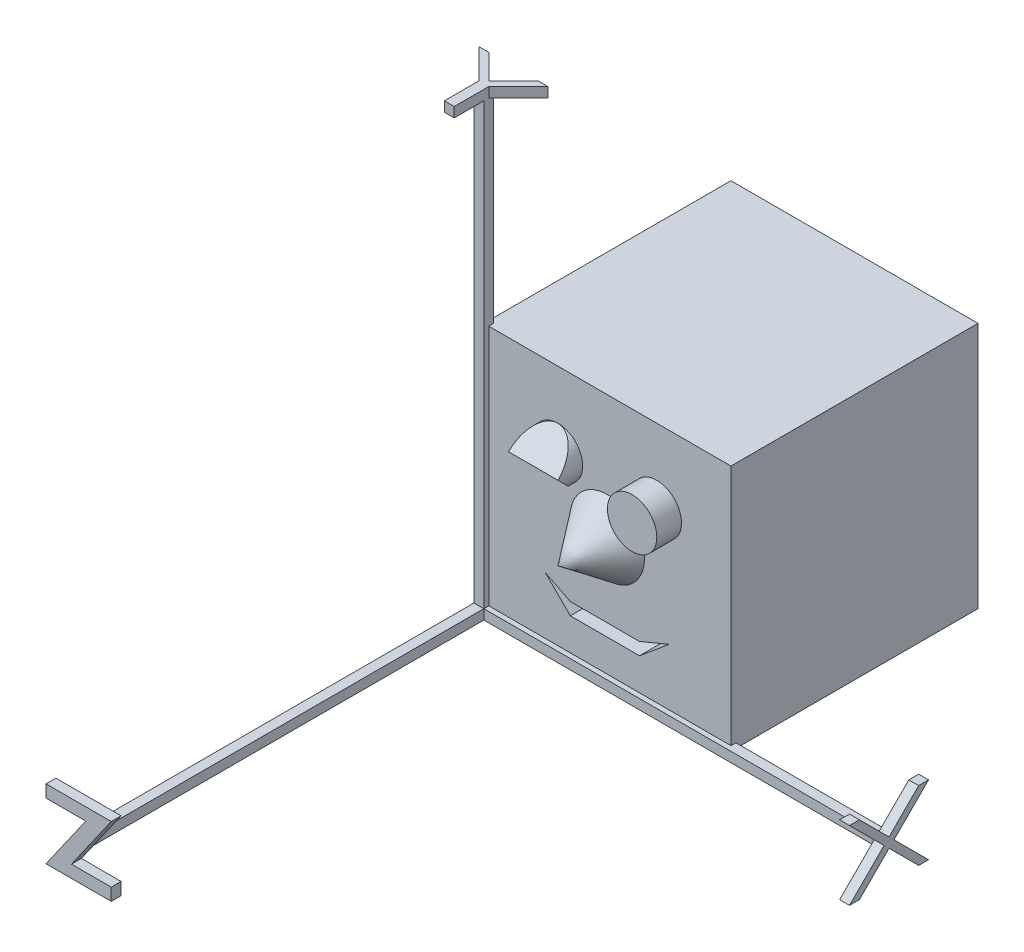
SolidWorks part; units mm, degrees
ref_plane "Front Plane" through (0, 0, 0) normal (0, 0, 1) x (1, 0, 0)
ref_plane "Top Plane" through (0, 0, 0) normal (0, 1, 0) x (1, 0, 0)
ref_plane "Right Plane" through (0, 0, 0) normal (1, 0, 0) x (0, 0, -1)
sketch "Sketch1" plane through (0, 0, 0) normal (0, 0, 1) x (1, 0, 0)
  line L1 (0, 0) -> (25, 0)
  line L2 (0, 0) -> (0, 25)
  line L3 (0, 25) -> (25, 25)
  line L4 (25, 0) -> (25, 25)
  dimension "D1" = 25
  dimension "D2" = 25
extrude "Extrude1" add sketch "Sketch1" against normal blind 25
sketch "Sketch2" plane through (0, 0, 0) normal (0, 0, 1) x (1, 0, 0)
  line L0 (0, 25) -> (0, 0) construction
  line L1 (25, 25) -> (0, 25) construction
  circle A0 centre (7.5, 17.5) radius 2.5
  dimension "D3" = 5
  dimension "D1" = 7.5
  dimension "D2" = 7.5
extrude "Extrude2" add sketch "Sketch2" along normal blind 10
sketch "Sketch3" plane through (0, 0, 0) normal (-1, 0, 0) x (0, 0, 1)
  line L0 (0, 20) -> (12, 20)
  line L1 (12, 20) -> (12, 15)
  line L2 (12, 15) -> (0, 15)
  line L3 (0, 15) -> (2.5, 17.5)
  line L4 (2.5, 17.5) -> (0, 20)
  line L6 (0, 25) -> (0, 0) construction
  line L7 (-25, 25) -> (0, 25) construction
  dimension "D1" = 12
  dimension "D2" = 12
  dimension "D3" = 5
  dimension "D4" = 5
  dimension "D5" = 2.5
  dimension "D6" = 2.5
extrude "Cut-Extrude1" cut sketch "Sketch3" against normal through all
sketch "Sketch4" plane through (0, 0, 0) normal (0, 0, 1) x (1, 0, 0)
  line L0 (0, 25) -> (0, 0) construction
  line L1 (25, 25) -> (0, 25) construction
  circle A0 centre (17.5, 17.5) radius 2.5
  dimension "D3" = 5
  dimension "D1" = 17.5
  dimension "D2" = 7.5
extrude "Extrude3" add sketch "Sketch4" along normal blind 2.5
sketch "Sketch9" plane through (0, 0, 0) normal (0, 0, 1) x (1, 0, 0)
  line L0 (0, 25) -> (0, 0) construction
  line L1 (25, 25) -> (0, 25) construction
  circle A0 centre (12.5, 12.5) radius 3.75
  dimension "D3" = 7.5
  dimension "D1" = 12.5
  dimension "D2" = 12.5
sketch "Sketch10" plane through (0, 0, 0) normal (0, 0, 1) x (1, 0, 0)
  line L0 (6.25, 6.25) -> (8.75, 5)
  line L1 (8.75, 5) -> (15.75, 5)
  line L2 (15.75, 5) -> (18.75, 6.25)
  line L3 (18.75, 6.25) -> (15.75, 3.75)
  line L4 (15.75, 3.75) -> (8.75, 3.75)
  line L5 (8.75, 3.75) -> (6.25, 6.25)
  line L6 (0, 25) -> (0, 0) construction
  line L7 (0, 0) -> (25, 0) construction
  dimension "D1" = 8.75
  dimension "D2" = 6.25
  dimension "D3" = 7
  dimension "D4" = 18.75
  dimension "D5" = 5
  dimension "D6" = 6.25
  dimension "D7" = 3.75
extrude "Cut-Extrude2" cut sketch "Sketch10" against normal blind 2.5
ref_plane "Plane1" through (12.5, 0, 0) normal (1, 0, 0) x (0, 0, -1)
sketch "Sketch13" plane through (12.5, 0, 0) normal (1, 0, 0) x (0, 0, -1)
  line L0 (0, 12.5) -> (-20.0611, 12.5) construction
  line L1 (0, 0) -> (0, 25) construction
  line L3 (0, 12.5) -> (-5, 12.5)
  line L4 (-5, 12.5) -> (0, 16.25)
  line L5 (0, 16.25) -> (0, 12.5)
  dimension "D1" = 5
  dimension "D2" = 3.75
revolve "Revolve1" add sketch "Sketch13" angle 360 about L0
sketch "Sketch14" plane through (0, 0, 0) normal (0, -1, 0) x (1, 0, 0)
  line L0 (0, -25) -> (0, 0) construction
  line L1 (-0.5, -0.5) -> (0.5, -0.5)
  line L2 (-0.5, -0.5) -> (-0.5, 0.5)
  line L3 (-0.5, 0.5) -> (0.5, 0.5)
  line L4 (0.5, -0.5) -> (0.5, 0.5)
  line L5 (0, 0) -> (25, 0) construction
  dimension "D1" = 0.5
  dimension "D2" = 1
  dimension "D3" = 0.5
  dimension "D4" = 1
extrude "Extrude4" add sketch "Sketch14" against normal blind 45
sketch "Sketch16" plane through (0, 45, 0) normal (0, 1, 0) x (-1, 0, 0)
  line L0 (0.5, 3.5) -> (0.5, 0)
  line L1 (0.5, 0.5) -> (0.5, -0.5) construction
  line L2 (0.5, 0) -> (3.5, -3)
  line L3 (3.5, -3) -> (2.5, -3)
  line L4 (2.5, -3) -> (0, -0.5)
  line L5 (0.5, -0.5) -> (-0.5, -0.5) construction
  line L6 (0, -0.5) -> (-2.5, -3)
  line L7 (-2.5, -3) -> (-3.5, -3)
  line L8 (-3.5, -3) -> (-0.5, 0)
  line L9 (-0.5, -0.5) -> (-0.5, 0.5) construction
  line L10 (-0.5, 0) -> (-0.5, 3.5)
  line L11 (-0.5, 3.5) -> (0.5, 3.5)
  line L12 (-0.5, 0.5) -> (0.5, 0.5) construction
  dimension "D1" = 3
  dimension "D2" = 2.5
  dimension "D3" = 135
  dimension "D4" = 90
extrude "Extrude5" add sketch "Sketch16" along normal blind 1
sketch "Sketch17" plane through (0, 0, 0) normal (0, 0, 1) x (1, 0, 0)
  line L0 (0.5, 0) -> (25, 0) construction
  line L1 (-0.5, 0.5) -> (0.5, 0.5)
  line L2 (-0.5, 0.5) -> (-0.5, -0.5)
  line L3 (-0.5, -0.5) -> (0.5, -0.5)
  line L4 (0.5, 0.5) -> (0.5, -0.5)
  line L5 (0, 25) -> (0, 0) construction
  dimension "D1" = 0.5
  dimension "D2" = 1
  dimension "D3" = 0.5
  dimension "D4" = 1
extrude "Extrude6" add sketch "Sketch17" along normal blind 40
sketch "Sketch18" plane through (0, 0, 40) normal (0, 0, 1) x (1, 0, 0)
  line L0 (-0.5, 0.5) -> (0.7254, 2.25)
  line L1 (0.7254, 2.25) -> (-3.3008, 2.25)
  line L2 (-3.3008, 2.25) -> (-3.3008, 3.5)
  line L3 (-3.3008, 3.5) -> (3.3008, 3.5)
  line L4 (3.3008, 3.5) -> (0.5, -0.5)
  line L5 (0.5, -0.5) -> (-0.7254, -2.25)
  line L6 (-0.7254, -2.25) -> (3.3008, -2.25)
  line L7 (3.3008, -2.25) -> (3.3008, -3.5)
  line L8 (3.3008, -3.5) -> (-3.3008, -3.5)
  line L9 (-3.3008, -3.5) -> (-0.5, 0.5)
  line L10 (0.5, 0.5) -> (-0.5, 0.5) construction
  line L11 (-0.5, -0.5) -> (0.5, -0.5) construction
  line L12 (0.5, 0) -> (-0.5, 0) construction
  line L13 (0.5, 0) -> (25, 0) construction
  dimension "D1" = 55
  dimension "D2" = 3.5
  dimension "D3" = 3.5
  dimension "D4" = 1.25
extrude "Extrude7" add sketch "Sketch18" along normal blind 1
sketch "Sketch19" plane through (0, 0, 0) normal (-1, 0, 0) x (0, 0, 1)
  line L1 (-0.5, 0.5) -> (0.5, 0.5)
  line L2 (-0.5, 0.5) -> (-0.5, -0.5)
  line L3 (-0.5, -0.5) -> (0.5, -0.5)
  line L4 (0.5, 0.5) -> (0.5, -0.5)
  line L5 (-25, 0) -> (-0.5, 0) construction
  line L7 (0.5, 45) -> (0.5, 0.5) construction
  dimension "D1" = 1
  dimension "D2" = 1
  dimension "D3" = 0.5
  dimension "D4" = 1
extrude "Extrude8" add sketch "Sketch19" against normal blind 40
sketch "Sketch20" plane through (40, 0, 0) normal (1, 0, 0) x (0, 0, -1)
  line L0 (0, 0.5) -> (3, 3.5)
  line L1 (-0.5, 0.5) -> (0.5, 0.5) construction
  line L2 (3, 3.5) -> (4, 3.5)
  line L3 (4, 3.5) -> (0.5, 0)
  line L4 (0.5, 0.5) -> (0.5, -0.5) construction
  line L5 (0.5, 0) -> (4, -3.5)
  line L6 (4, -3.5) -> (3, -3.5)
  line L7 (3, -3.5) -> (0, -0.5)
  line L8 (0.5, -0.5) -> (-0.5, -0.5) construction
  line L9 (0, -0.5) -> (-3, -3.5)
  line L10 (-3, -3.5) -> (-4, -3.5)
  line L11 (-4, -3.5) -> (-0.5, 0)
  line L12 (-0.5, -0.5) -> (-0.5, 0.5) construction
  line L13 (-0.5, 0) -> (-4, 3.5)
  line L14 (-4, 3.5) -> (-3, 3.5)
  line L15 (-3, 3.5) -> (0, 0.5)
  line L16 (0, 0.5) -> (0, 25) construction
  dimension "D1" = 3.5
  dimension "D2" = 3.5
  dimension "D3" = 45
extrude "Extrude9" add sketch "Sketch20" along normal blind 1
